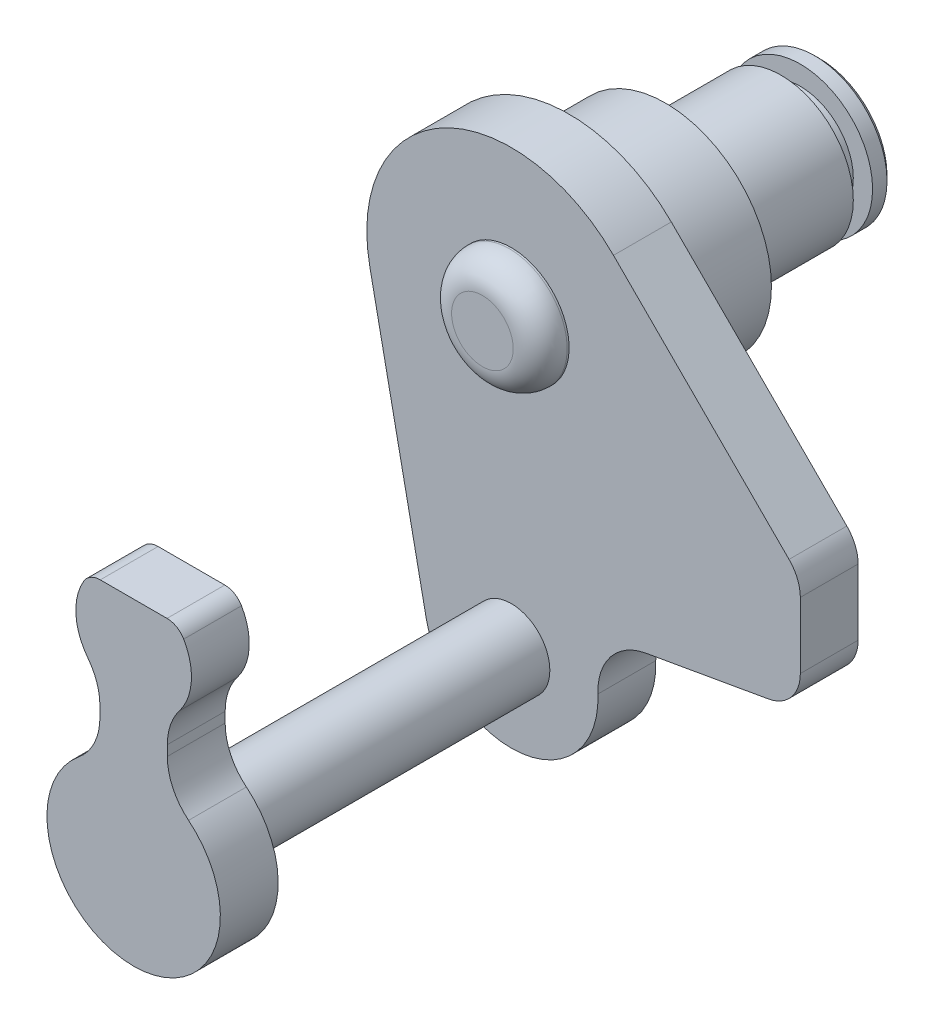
SolidWorks part; units mm, degrees
ref_plane "Plan de face" through (0, 0, 0) normal (0, 0, 1) x (1, 0, 0)
ref_plane "Plan de dessus" through (0, 0, 0) normal (0, 1, 0) x (1, 0, 0)
ref_plane "Plan de droite" through (0, 0, 0) normal (1, 0, 0) x (0, 0, -1)
sketch "Esquisse1" plane through (0, 0, 0) normal (0, 0, 1) x (1, 0, 0)
  line L0 (0, 10) -> (0, 0) construction
  line L1 (-2.2361, 12) -> (2.2361, 12)
  line L2 (-1.75, 4.1458) -> (-1.75, 7.5633)
  line L4 (1.75, 4.1458) -> (1.75, 7.5633)
  arc A0 (-1.75, 4.1458) -> (1.75, 4.1458) centre (0, 0) ccw
  arc A1 (1.75, 7.5633) -> (2.2361, 12) centre (0, 10) ccw
  arc A2 (-2.2361, 12) -> (-1.75, 7.5633) centre (0, 10) ccw
  dimension "D1" = 9
  dimension "D2" = 6
  dimension "D3" = 10
  dimension "D4" = 3.5
  dimension "D5" = 12
extrude "Extrusion1" add sketch "Esquisse1" along normal blind 3
fillet "Congé1" radius 1 2 edges at (-2.2361, 12, 1.5) (2.2361, 12, 1.5)
fillet "Congé3" radius 3 4 edges at (1.75, 7.5633, 1.5) (1.75, 4.1458, 1.5) (-1.75, 4.1458, 1.5) (-1.75, 7.5633, 1.5)
sketch "Esquisse2" plane through (0, 0, 0) normal (0, 0, -1) x (-1, 0, 0)
  circle A0 centre (0, 0) radius 2
  dimension "D1" = 4
extrude "Extrusion2" add sketch "Esquisse2" along normal blind 16.6
sketch "Esquisse3" plane through (0, 0, -16.6) normal (0, 0, -1) x (-1, 0, 0)
  line L0 (-15, 4.6758) -> (-3.6226, 2.6696)
  line L1 (-15, 4.6758) -> (-15, 10.6066)
  line L2 (-5.3033, 20.3033) -> (-15, 10.6066)
  line L3 (7.3485, 13.5) -> (4.4091, -0.9)
  arc A0 (7.3485, 13.5) -> (-5.3033, 20.3033) centre (0, 15) ccw
  arc A1 (-3.6226, 2.6696) -> (4.4091, -0.9) centre (0, 0) ccw
  dimension "D2" = 9
  dimension "D7" = 15
  dimension "D1" = 15
  dimension "D3" = 15
  dimension "D4" = 100
  dimension "D5" = 2
  dimension "D6" = 135
extrude "Extrusion3" add sketch "Esquisse3" along normal blind 3
fillet "Congé4" radius 3 1 edges at (3.6226, 2.6696, -18.1)
fillet "Congé5" radius 2 2 edges at (15, 4.6758, -18.1) (15, 10.6066, -18.1)
sketch "Esquisse4" plane through (0, 0, -19.6) normal (0, 0, -1) x (-1, 0, 0)
  line L0 (-1.6583, 2.5) -> (1.6583, 2.5)
  line L1 (-1.6583, -2.5) -> (1.6583, -2.5)
  arc A0 (-1.6583, 2.5) -> (-1.6583, -2.5) centre (0, 0) ccw
  arc A1 (1.6583, -2.5) -> (1.6583, 2.5) centre (0, 0) ccw
  dimension "D1" = 6
  dimension "D2" = 5
  dimension "D3" = 2.5
extrude "Extrusion4" add sketch "Esquisse4" along normal blind 0.5
ref_point "Point1"
sketch "Esquisse6" plane through (0, 0, 0) normal (1, 0, 0) x (0, 0, -1)
  line L0 (19.6, 15) -> (37.6476, 15) construction
  line L1 (19.6, 20.5) -> (24.6, 20.5)
  line L2 (19.6, 20.3033) -> (19.6, 11.1924) construction
  line L3 (24.6, 20.5) -> (24.6, 18.75)
  line L4 (24.6, 18.75) -> (30.6, 18.75)
  line L5 (30.6, 18.75) -> (30.6, 17.75)
  line L6 (30.6, 17.75) -> (31.6, 17.75)
  line L7 (31.6, 17.75) -> (31.6, 18.75)
  line L8 (31.6, 18.75) -> (32.6, 18.75)
  line L9 (32.6, 18.75) -> (32.6, 15)
  line L10 (32.6, 15) -> (15.1, 15)
  line L11 (15.1, 15) -> (15.1, 18)
  line L12 (15.1, 18) -> (19.6, 18)
  line L13 (19.6, 18) -> (19.6, 20.5)
  line L14 (16.6, 20.3033) -> (16.6, 11.1924) construction
  dimension "D1" = 5
  dimension "D2" = 8
  dimension "D3" = 1
  dimension "D4" = 1
  dimension "D5" = 1.5
  dimension "D6" = 11
  dimension "D7" = 7.5
  dimension "D8" = 1
  dimension "D9" = 6
revolve "Révolution1" add sketch "Esquisse6" angle 360 about L0
fillet "Congé6" radius 1.4 1 edges at (3, 15, -15.1)
chamfer "Chanfrein1" distance 0.25 angle 45 1 edges at (3.75, 15, -32.6)
